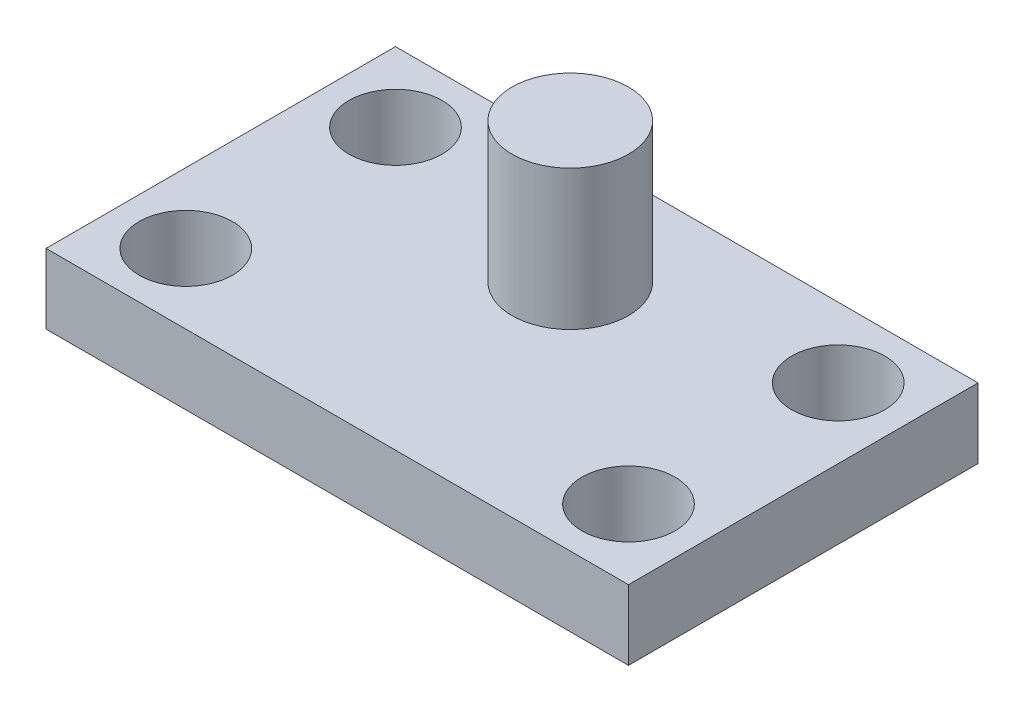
SolidWorks part; units mm, degrees
ref_plane "Front Plane" through (0, 0, 0) normal (0, 0, 1) x (1, 0, 0)
ref_plane "Top Plane" through (0, 0, 0) normal (0, 1, 0) x (1, 0, 0)
ref_plane "Right Plane" through (0, 0, 0) normal (1, 0, 0) x (0, 0, -1)
sketch "Sketch1" plane through (0, 0, 0) normal (0, 1, 0) x (1, 0, 0)
  line L1 (0, 0) -> (250, 0)
  line L2 (0, 0) -> (0, 150)
  line L3 (0, 150) -> (250, 150)
  line L4 (250, 0) -> (250, 150)
  circle A0 centre (30, 120) radius 20
  circle A1 centre (30, 30) radius 20
  circle A2 centre (220, 30) radius 20
  circle A3 centre (220, 120) radius 20
  point P13 (0, 0)
  point P14 (0, 0)
  point P15 (0, 0)
  point P16 (0, 0)
  dimension "D3" = 40
  dimension "D4" = 30
  dimension "D1" = 250
  dimension "D2" = 150
  dimension "D5" = 30
  dimension "D6" = 190
  dimension "D7" = 90
extrude "Boss-Extrude1" add sketch "Sketch1" along normal blind 30
sketch "Sketch2" plane through (0, 0, 0) normal (0, -1, 0) x (1, 0, 0)
  line L0 (0, 0) -> (250, 0) construction
  line L1 (250, 0) -> (250, -150) construction
  circle A0 centre (125, -100) radius 25
  dimension "D1" = 50
  dimension "D2" = 100
  dimension "D3" = 125
extrude "Boss-Extrude2" add sketch "Sketch2" against normal blind 90
